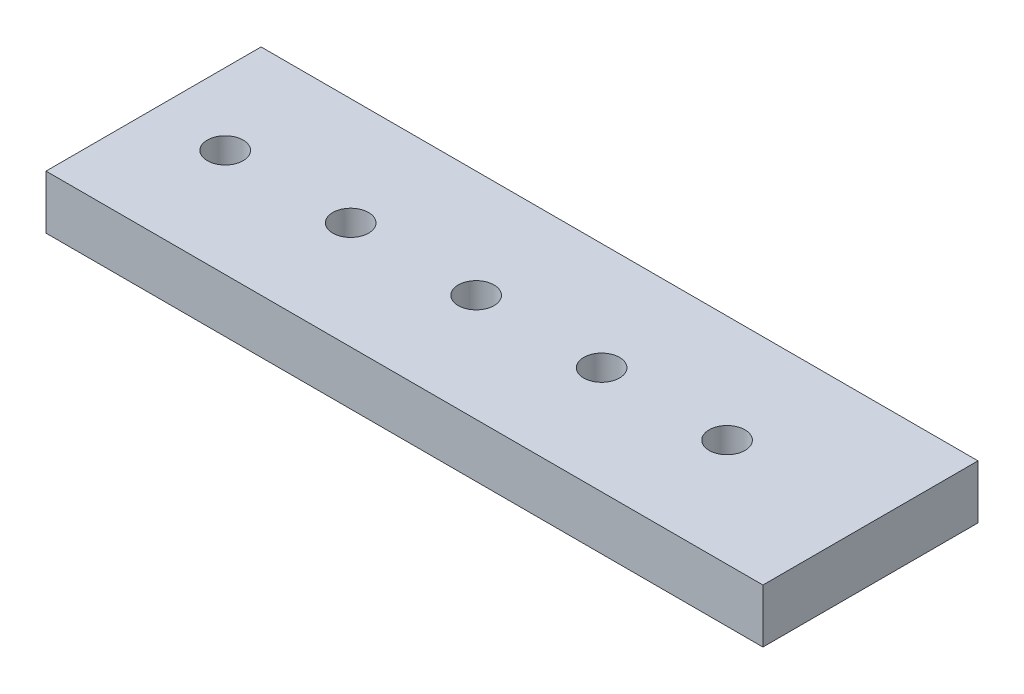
SolidWorks part; units mm, degrees
ref_plane "前视基准面" through (0, 0, 0) normal (0, 0, 1) x (1, 0, 0)
ref_plane "上视基准面" through (0, 0, 0) normal (0, 1, 0) x (1, 0, 0)
ref_plane "右视基准面" through (0, 0, 0) normal (1, 0, 0) x (0, 0, -1)
other "Configuration Table"
sketch "BaseSketch" plane through (0, 0, 0) normal (0, 1, 0) x (1, 0, 0)
  line L1 (0, 0) -> (200, 0)
  line L2 (0, 0) -> (0, 60)
  line L3 (0, 60) -> (200, 60)
  line L4 (200, 0) -> (200, 60)
  dimension "D1" = 200
  dimension "D2" = 60
extrude "BaseBoss" add sketch "BaseSketch" against normal blind 15
sketch "SeedHoleSketch" plane through (0, 0, 0) normal (0, 1, 0) x (1, 0, 0)
  circle A0 centre (20, 30) radius 5
  dimension "D1" = 10
extrude "SeedHoleCut" cut sketch "SeedHoleSketch" against normal blind 15
pattern_linear "HolesLinearPattern" count 5 spacing 35 along (1, 0, 0) of "SeedHoleCut"
